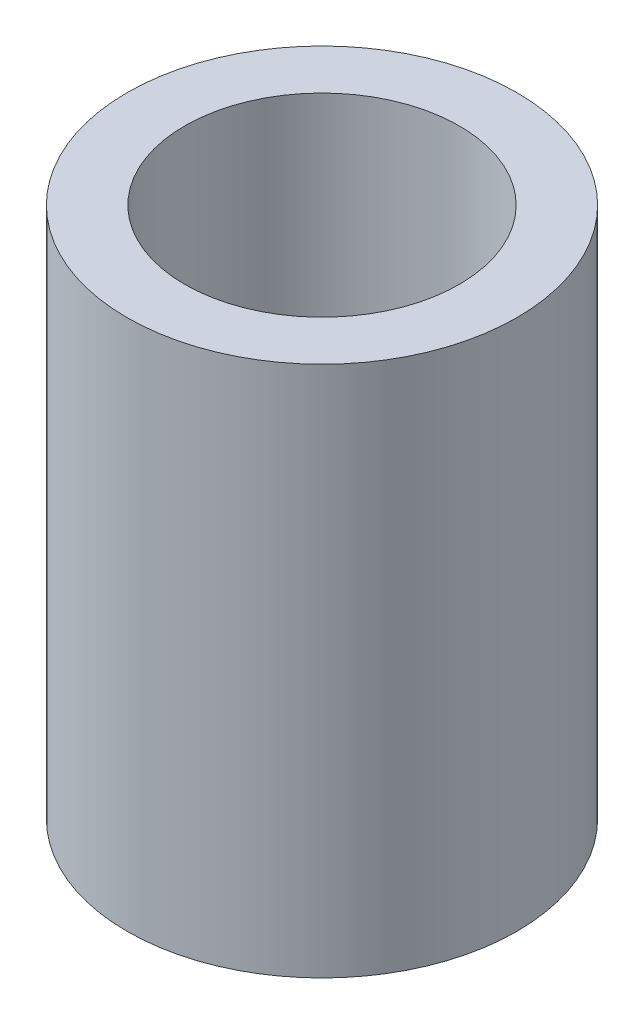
SolidWorks part; units mm, degrees
ref_plane "Plan de face" through (0, 0, 0) normal (0, 0, 1) x (1, 0, 0)
ref_plane "Plan de dessus" through (0, 0, 0) normal (0, 1, 0) x (1, 0, 0)
ref_plane "Plan de droite" through (0, 0, 0) normal (1, 0, 0) x (0, 0, -1)
sketch "Esquisse1" plane through (0, 0, 0) normal (0, 1, 0) x (1, 0, 0)
  circle A0 centre (0, 0) radius 7.75
  circle A1 centre (0, 0) radius 11
  dimension "D1" = 15.5
  dimension "D2" = 22
extrude "Extrusion1" add sketch "Esquisse1" along normal blind 30
